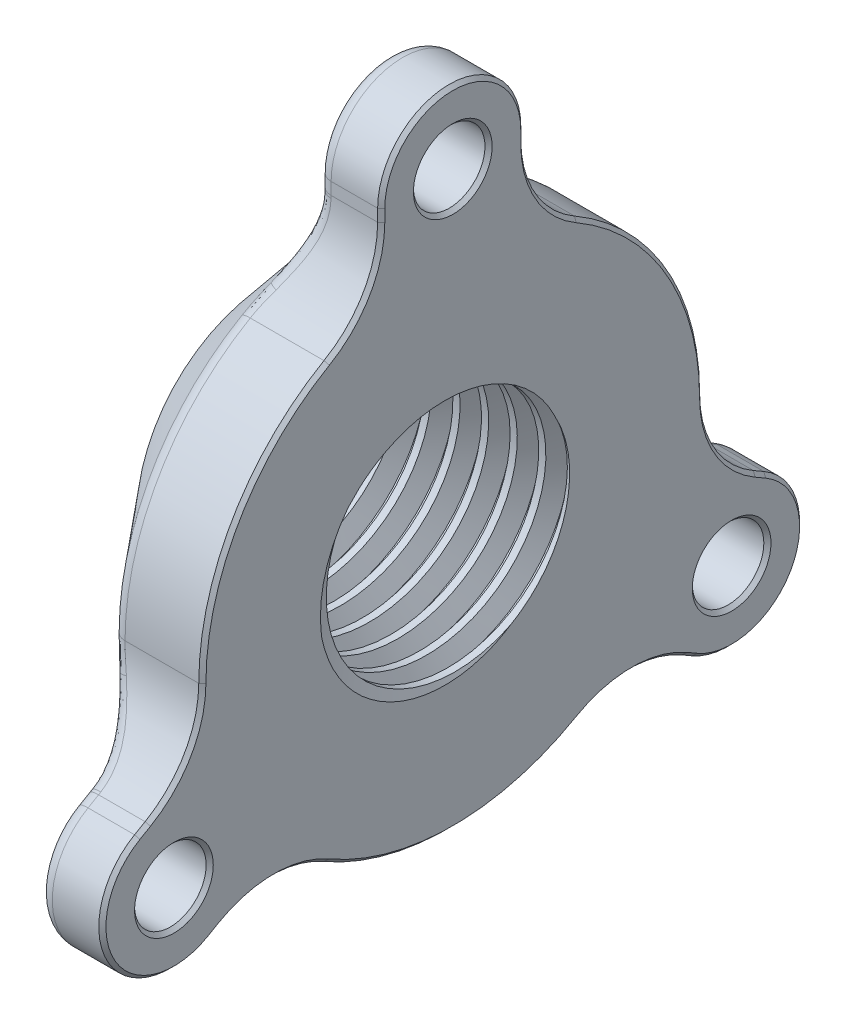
SolidWorks part; units mm, degrees
ref_plane "Płaszczyzna przednia" through (0, 0, 0) normal (0, 0, 1) x (1, 0, 0)
ref_plane "Płaszczyzna górna" through (0, 0, 0) normal (0, 1, 0) x (1, 0, 0)
ref_plane "Płaszczyzna prawa" through (0, 0, 0) normal (1, 0, 0) x (0, 0, -1)
sketch "Szkic1" plane through (0, 0, 0) normal (0, 0, 1) x (1, 0, 0)
  line L0 (0, 0) -> (18463.2908, 0) construction
  line L1 (0, 3.25) -> (0, 18)
  line L2 (0, 18) -> (14.2647, 35)
  line L3 (14.2647, 35) -> (16, 35)
  line L4 (16, 35) -> (16, 3.25)
  line L5 (16, 3.25) -> (0, 3.25)
  dimension "D1" = 6.5
  dimension "D2" = 70
  dimension "D3" = 36
  dimension "D4" = 140
  dimension "D5" = 16
revolve "Obrót1" add sketch "Szkic1" angle 360 about L0
sketch "Szkic2" plane through (16, 0, 0) normal (1, 0, 0) x (0, 0, -1)
  circle A0 centre (0, 0) radius 18.5
  dimension "D1" = 37
extrude "Wytnij-wyciągnięcie1" cut sketch "Szkic2" against normal through all
sketch "Szkic7" plane through (16, 0, 0) normal (1, 0, 0) x (0, 0, -1)
  circle A0 centre (0, 0) radius 18.5 construction
  circle A1 centre (0, 0) radius 35
  circle A2 centre (0, 0) radius 35
  circle A3 centre (0, 0) radius 18.5
  dimension "D1" = 0
extrude "Dodanie-wyciągnięcie1" add sketch "Szkic7" along normal blind 10
thread "Gwint1" pitch 4 start angle 0, offset 4, length 0, pitch 4, diameter 37
ref_plane "Płaszczyzna1" through (-3.5805, 0, -18.5) normal (0, -1, 0) x (0, 0, -1)
sketch "Profil gwintu1" plane through (-3.5805, 0, -18.5) normal (0, -1, 0) x (0, 0, -1)
  line L0 (0, 0) -> (0, 4) construction
  line L11 (0, 0) -> (0, 3.5)
  line L12 (0, 3.5) -> (-2.1651, 2.25)
  line L13 (-2.1651, 2.25) -> (-2.1651, 1.25)
  line L15 (-2.1651, 1.25) -> (0, 0)
  line L17 (-2.1651, 1.75) -> (0, 1.75) construction
  point P2 (0, 0)
  dimension "Pitch" = 4
  dimension "Profile_Angle" = 60
  dimension "Profile_Land" = 1
  dimension "Profile_Height" = 2.1651
sketch "Szkic5" plane through (0, 0, 0) normal (0, 0, 1) x (1, 0, 0)
  line L1 (-10.4477, 19.0062) -> (1, 19.0062)
  line L2 (-10.4477, 19.0062) -> (-10.4477, -21.5012)
  line L3 (-10.4477, -21.5012) -> (1, -21.5012)
  line L4 (1, 19.0062) -> (1, -21.5012)
  line L5 (26, -35) -> (26, 35) construction
  dimension "D1" = 25
extrude "Wytnij-wyciągnięcie2" cut sketch "Szkic5" against normal through all both and the other way through all
sketch "Szkic9" plane through (26, 0, 0) normal (1, 0, 0) x (0, 0, -1)
  line L0 (0, 0) -> (0, 45) construction
  line L1 (0, 45) -> (0, 33.541) construction
  line L2 (10, 45) -> (10, 33.541)
  line L3 (-10, 45) -> (-10, 33.541)
  line L4 (0, 0) -> (44.9938, 25.9772) construction
  line L5 (0, 0) -> (-41.401, 23.9029) construction
  line L6 (38.9711, -22.5) -> (29.0474, -16.7705) construction
  line L7 (43.9711, -13.8397) -> (34.0474, -8.1103)
  line L8 (33.9711, -31.1603) -> (24.0474, -25.4308)
  line L9 (-38.9711, -22.5) -> (-29.0474, -16.7705) construction
  line L10 (-33.9711, -31.1603) -> (-24.0474, -25.4308)
  line L11 (-43.9711, -13.8397) -> (-34.0474, -8.1103)
  arc A4 (10, 45) -> (-10, 45) centre (0, 45) ccw
  arc A5 (-10, 33.541) -> (10, 33.541) centre (0, 33.541) ccw
  circle A6 centre (0, 0) radius 35 construction
  arc A7 (43.9711, -13.8397) -> (33.9711, -31.1603) centre (38.9711, -22.5) cw
  arc A8 (24.0474, -25.4308) -> (34.0474, -8.1103) centre (29.0474, -16.7705) cw
  arc A9 (-33.9711, -31.1603) -> (-43.9711, -13.8397) centre (-38.9711, -22.5) cw
  arc A10 (-34.0474, -8.1103) -> (-24.0474, -25.4308) centre (-29.0474, -16.7705) cw
  point P1 (0, 39.2705)
  point P13 (34.0093, -19.6353)
  point P22 (-34.0093, -19.6353)
  dimension "D1" = 20
  dimension "D2" = 45
  dimension "D3" = 60
  dimension "D4" = 60
extrude "Dodanie-wyciągnięcie2" add sketch "Szkic9" against normal blind 9
fillet "Zaokrąglenie1" radius 15 6 edges at (21.5, -25.4308, 24.0474) (21.5, -25.4308, -24.0474) (21.5, -8.1103, -34.0474) (21.5, 33.541, -10) (21.5, -8.1103, 34.0474) (21.5, 33.541, 10)
hole_wizard "Otwór Ø10.0 (10)1" positions "Szkic10" profile "Szkic11" hole size "Ø10.0" standard "DIN"
sketch "Szkic10" plane through (17, 0, 0) normal (-1, 0, 0) x (0, 0, 1)
  point P0 (-38.9711, -22.5)
  point P3 (38.9711, -22.5)
  point P6 (0, 45)
sketch "Szkic11" plane through (17, -22.5, -38.9711) normal (0, 1, 0) x (0, 0, 1)
  line L0 (0, 0) -> (0, 28.0043)
  line L1 (0, 28.0043) -> (5, 25)
  line L2 (5, 25) -> (5, 0)
  line L5 (5, 0) -> (0, 0)
  line L10 (0, 28.0043) -> (-5, 25) construction
  line L11 (0, -6.35) -> (0, 107.95) construction
  dimension "Średnica otworu" = 10
  dimension "Głębokość otworu" = 25
  dimension "Kąt wiertła" = 118
fillet "Zaokrąglenie2" radius 15 3 edges at (17, -17.5, 30.3109) (17, 35, 0) (17, -17.5, -30.3109)
fillet "Zaokrąglenie3" radius 2 24 edges at (14.2647, 17.5, 30.3109) (15.2688, 34.2385, 13.0473) (17, 42.885, 10.0058) (17, 44.1506, 10) (17, 55, 0) (17, 44.1506, -10) (17, 42.885, -10.0058) (16.0801, 36.6939, -11.5337) (14.2647, 17.5, -30.3109) (15.2688, -5.8199, -36.1751) (17, -12.7772, -42.1424) (17, -13.4151, -43.2356) (17, -27.5, -47.6314) (17, -30.7356, -33.2356) (17, -30.1078, -32.1366) (16.0801, -28.3354, -26.011) (14.2647, -35, 0) (15.2688, -28.4186, 23.1278) (17, -30.1078, 32.1366) (17, -30.7356, 33.2356) (17, -27.5, 47.6314) (17, -13.4151, 43.2356) (17, -12.7772, 42.1424) (16.0801, -8.3585, 37.5447)
chamfer "Sfazowanie1" distance 0.5 angle 45 21 edges at (26, -13.4151, -43.2356) (26, -27.5, -47.6314) (26, -30.7356, 33.2356) (26, -27.5, 47.6314) (26, 17.5, 30.3109) (26, 17.5, -30.3109) (26, -35, 0) (26, -30.7356, -33.2356) (26, 44.1506, -10) (26, -13.4151, 43.2356) (26, -28.3013, 25) (26, -28.3013, -25) (26, -7.5, -37.0096) (26, 35.8013, -12.0096) (26, -7.5, 37.0096) (26, 35.8013, 12.0096) (26, 45, -5) (26, -22.5, 33.9711) (26, -22.5, -43.9711) (26, 55, 0) (26, 44.1506, 10)
